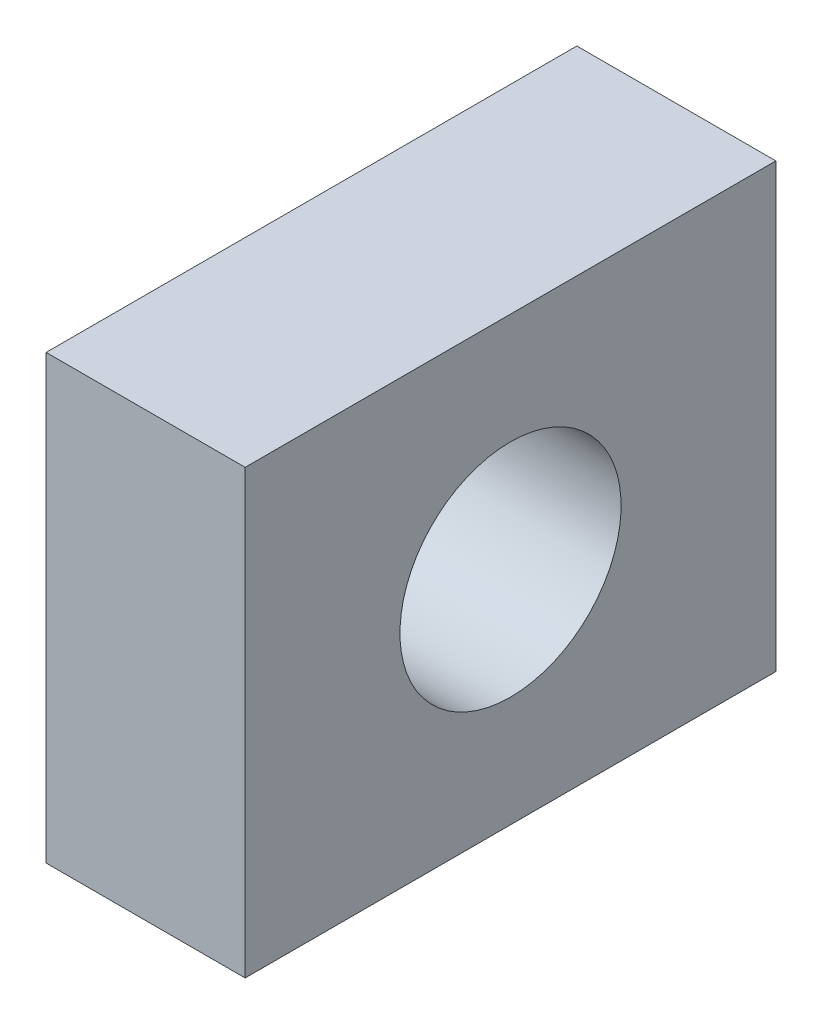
SolidWorks part; units mm, degrees
ref_plane "Plan de face" through (0, 0, 0) normal (0, 0, 1) x (1, 0, 0)
ref_plane "Plan de dessus" through (0, 0, 0) normal (0, 1, 0) x (1, 0, 0)
ref_plane "Plan de droite" through (0, 0, 0) normal (1, 0, 0) x (0, 0, -1)
sketch "Esquisse1" plane through (0, 0, 0) normal (0, 0, 1) x (1, 0, 0)
  line L1 (-22.2491, 23.6646) -> (-13.2491, 23.6646)
  line L2 (-22.2491, 23.6646) -> (-22.2491, 3.6646)
  line L3 (-22.2491, 3.6646) -> (-13.2491, 3.6646)
  line L4 (-13.2491, 23.6646) -> (-13.2491, 3.6646)
  dimension "D1" = 9
  dimension "D2" = 20
extrude "Boss.-Extru.1" add sketch "Esquisse1" along normal blind 24
sketch "Esquisse2" plane through (-13.2491, 0, 0) normal (1, 0, 0) x (0, 0, -1)
  line L0 (-24, 23.6646) -> (0, 23.6646) construction
  line L1 (0, 3.6646) -> (0, 23.6646) construction
  circle A0 centre (-12, 13.6646) radius 5
  point P4 (0, 13.6646)
  dimension "D1" = 10
  dimension "D2" = 10
  dimension "D3" = 12
extrude "Enlèv. mat.-Extru.1" cut sketch "Esquisse2" against normal through all
